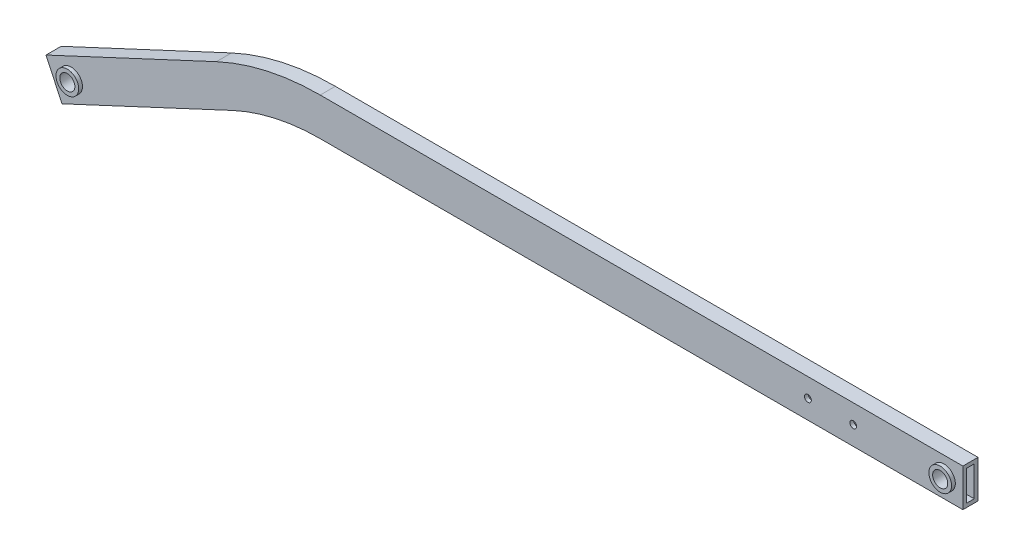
SolidWorks part; units mm, degrees
ref_plane "Plan de face" through (0, 0, 0) normal (0, 0, 1) x (1, 0, 0)
ref_plane "Plan de dessus" through (0, 0, 0) normal (0, 1, 0) x (1, 0, 0)
ref_plane "Plan de droite" through (0, 0, 0) normal (1, 0, 0) x (0, 0, -1)
sketch "Esquisse1" plane through (0, 0, 0) normal (0, 0, 1) x (1, 0, 0)
  line L0 (-850, 0) -> (0, 0)
  line L1 (-976.7855, -28.1077) -> (-1202.15, -133.1969)
  arc A0 (-850, 0) -> (-976.7855, -28.1077) centre (-850, -300) ccw
  dimension "D2" = 300
  dimension "D1" = 155
  dimension "D3" = 1202.15
  dimension "D4" = 850
sketch "Esquisse3" plane through (0, 0, 0) normal (1, 0, 0) x (0, 0, -1)
  line L0 (-10, 25) -> (10, 25)
  line L1 (-5, 20) -> (5, 20)
  line L2 (-5, 20) -> (-5, -20)
  line L3 (-5, -20) -> (5, -20)
  line L4 (5, 20) -> (5, -20)
  line L5 (10, 25) -> (10, -25)
  line L6 (-10, -25) -> (10, -25)
  line L7 (-10, 25) -> (-10, -25)
  dimension "D1" = 25
  dimension "D2" = 25
  dimension "D3" = 10
  dimension "D4" = 20
  dimension "D5" = 5
sweep "Balayage1" add profiles "Esquisse3" path "Esquisse1"
sketch "Esquisse4" plane through (0, 0, 10) normal (0, 0, 1) x (1, 0, 0)
  line L0 (0, 25) -> (0, -25) construction
  line L1 (-966.22, -50.7654) -> (-1191.5845, -155.8546) construction
  line L2 (-1212.7155, -110.5392) -> (-1191.5845, -155.8546) construction
  line L4 (-850, -25) -> (0, -25) construction
  circle A0 centre (-1179.4923, -122.6314) radius 15
  circle A1 centre (-25, 0) radius 15
  dimension "D1" = 30
  dimension "D2" = 25
  dimension "D3" = 30
  dimension "D6" = 25
  dimension "D4" = 25
  dimension "D5" = 25
extrude "Enlèv. mat.-Extru.1" cut sketch "Esquisse4" against normal through all
sketch "Esquisse5" plane through (0, 0, 10) normal (0, 0, 1) x (1, 0, 0)
  circle A0 centre (-25, 0) radius 15 construction
  circle A1 centre (-25, 0) radius 15
  circle A2 centre (-25, 0) radius 10
  dimension "D1" = 5
extrude "Extrusion1" add sketch "Esquisse5" along normal blind 5 and the other way blind 25
sketch "Esquisse6" plane through (0, 0, 10) normal (0, 0, 1) x (1, 0, 0)
  circle A0 centre (-1179.4923, -122.6314) radius 15 construction
  circle A1 centre (-1179.4923, -122.6314) radius 15
  circle A2 centre (-1179.4923, -122.6314) radius 10
  dimension "D1" = 5
extrude "Extrusion2" add sketch "Esquisse6" along normal blind 5 and the other way blind 25
sketch "Esquisse7" plane through (0, 0, -10) normal (0, 0, -1) x (-1, 0, 0)
  line L0 (850, -25) -> (0, -25) construction
  circle A0 centre (145, 0) radius 4.5
  circle A1 centre (205, 0) radius 4.5
  circle A2 centre (25, 0) radius 10 construction
  dimension "D1" = 120
  dimension "D2" = 60
  dimension "D3" = 9
  dimension "D4" = 9
  dimension "D5" = 25
extrude "Enlèv. mat.-Extru.2" cut sketch "Esquisse7" against normal through all
